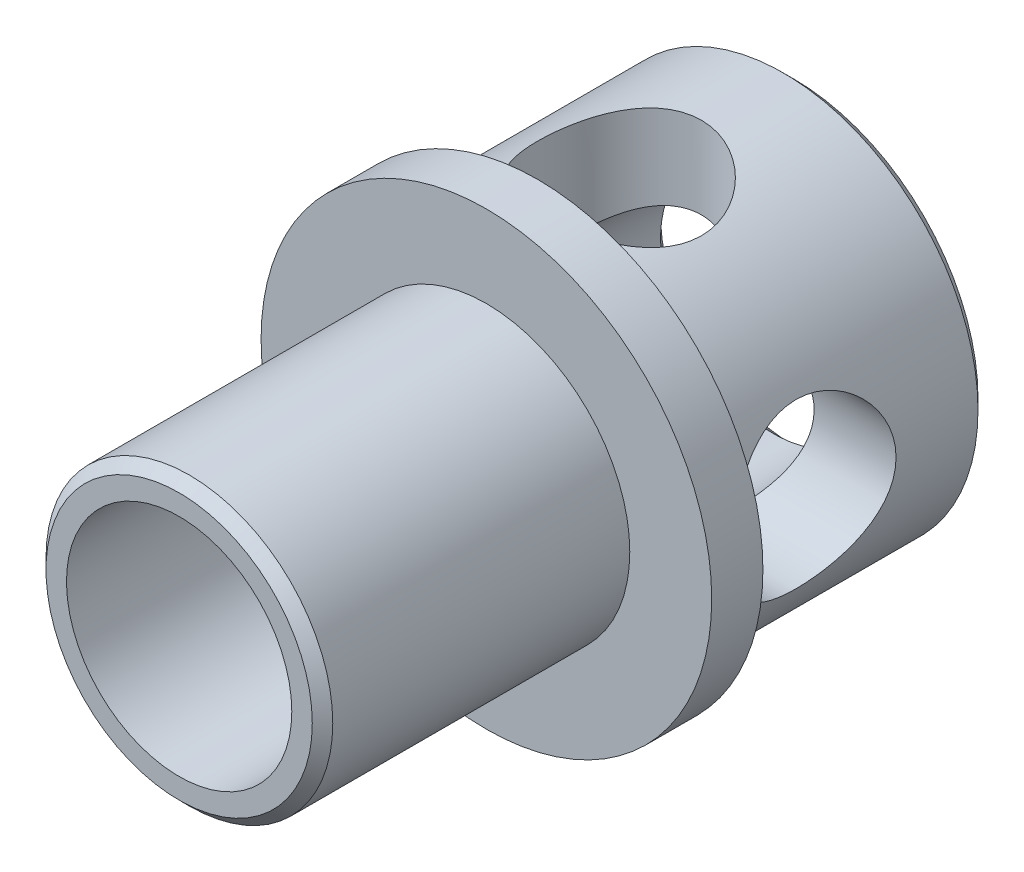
SolidWorks part; units mm, degrees
ref_plane "Plane1" through (0, 0, 0) normal (0, 0, 1) x (1, 0, 0)
ref_plane "Plane2" through (0, 0, 0) normal (0, 1, 0) x (1, 0, 0)
ref_plane "Plane3" through (0, 0, 0) normal (1, 0, 0) x (0, 0, -1)
sketch "Esquisse1" plane through (0, 0, 0) normal (0, 0, 1) x (1, 0, 0)
  circle A0 centre (0, 0) radius 5.5
  circle A1 centre (0, 0) radius 9.5
  dimension "D1" = 11
  dimension "D2" = 19
extrude "Base-Extrusion" add sketch "Esquisse1" along normal blind 30
sketch "Esquisse2" plane through (0, 0, 30) normal (0, 0, 1) x (1, 0, 0)
  circle A0 centre (0, 0) radius 7
  circle A1 centre (0, 0) radius 9.5 construction
  circle A2 centre (0, 0) radius 9.5
  point P2 (0, 0)
  dimension "D1" = 14
extrude "Enlèv. mat.-Extru.1" cut sketch "Esquisse2" against normal blind 15
sketch "Esquisse3" plane through (0, 0, 15) normal (0, 0, 1) x (1, 0, 0)
  circle A0 centre (0, 0) radius 11
  dimension "D1" = 22
extrude "Boss.-Extru.1" add sketch "Esquisse3" against normal blind 2.5
chamfer "Chanfrein5" distance 1 angle 45
chamfer "Chanfrein6" distance 0.5 angle 45
sketch "Esquisse4" plane through (0, 0, 15) normal (0, 0, 1) x (1, 0, 0)
  circle A1 centre (0, 0) radius 5.5
  circle A2 centre (0, 0) radius 5.5
  dimension "D1" = 0
extrude "Enlèv. mat.-Extru.2" cut sketch "Esquisse4" against normal through all
chamfer "Chanfrein7" distance 0.5 angle 45
sketch "Esquisse5" plane through (0, 0, 0) normal (1, 0, 0) x (0, 0, -1)
  line L0 (-30, 0) -> (-1, 0) construction
  line L1 (0, -9) -> (0, 9) construction
  circle A0 centre (-8.5, 0) radius 4
  dimension "D1" = 8
  dimension "D2" = 8.5
extrude "Enlèv. mat.-Extru.3" cut sketch "Esquisse5" against normal through all and the other way through all
sketch "Esquisse6" plane through (0, 0, 0) normal (0, 1, 0) x (1, 0, 0)
  line L0 (0, -30) -> (0, -1) construction
  line L1 (6.5, 0) -> (-6.5, 0) construction
  circle A0 centre (0, -8.5) radius 4
  dimension "D1" = 8
  dimension "D2" = 8.5
extrude "Enlèv. mat.-Extru.4" cut sketch "Esquisse6" against normal through all and the other way through all
